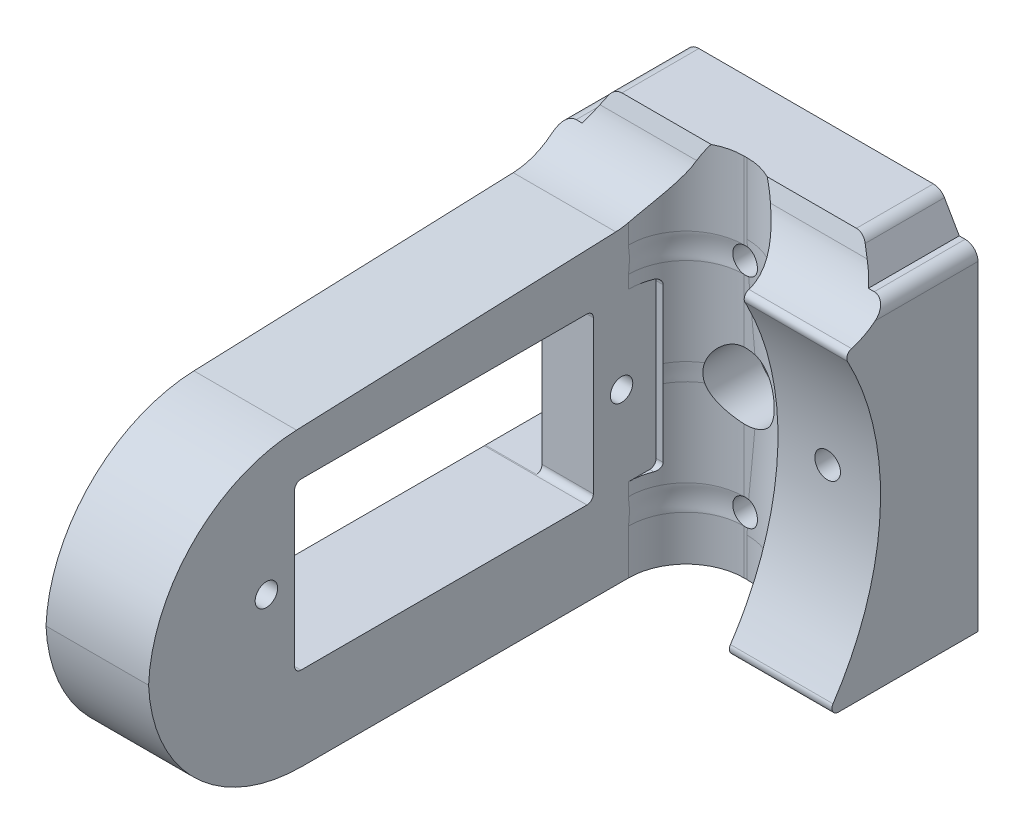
SolidWorks part; units mm, degrees
ref_plane "Front Plane" through (0, 0, 0) normal (0, 0, 1) x (1, 0, 0)
ref_plane "Top Plane" through (0, 0, 0) normal (0, 1, 0) x (1, 0, 0)
ref_plane "Right Plane" through (0, 0, 0) normal (1, 0, 0) x (0, 0, -1)
sketch "Sketch1" plane through (0, 0, 0) normal (0, 0, 1) x (1, 0, 0)
  line L0 (-508.3457, 285.8994) -> (-508.3457, 283.7994) construction
  line L1 (-509.3071, 286.3994) -> (-508.8457, 286.3994) construction
  line L2 (-532.5957, 283.7994) -> (-532.5957, 285.8994) construction
  line L3 (-532.0957, 286.3994) -> (-531.6344, 286.3994) construction
  line L4 (-531.2014, 286.6494) -> (-530.0467, 288.6494) construction
  line L5 (-510.8948, 288.6494) -> (-509.7401, 286.6494) construction
  line L6 (-529.6137, 288.8994) -> (-511.3278, 288.8994) construction
  line L7 (-508.3457, 285.8994) -> (-508.3457, 283.7994) construction
  line L8 (-509.3071, 286.3994) -> (-508.8457, 286.3994) construction
  line L9 (-532.5957, 283.7994) -> (-532.5957, 285.8994) construction
  line L10 (-532.0957, 286.3994) -> (-531.6344, 286.3994) construction
  line L11 (-531.2014, 286.6494) -> (-530.0467, 288.6494) construction
  line L12 (-510.8948, 288.6494) -> (-509.7401, 286.6494) construction
  line L13 (-529.6137, 288.8994) -> (-511.3278, 288.8994) construction
  line L14 (-532.5957, 283.7994) -> (-532.5957, 261.3994) construction
  line L15 (-506.3457, 261.3994) -> (-534.5957, 261.3994) construction
  line L16 (-532.5957, 261.3994) -> (-508.3457, 261.3994) construction
  line L17 (-508.3457, 261.3994) -> (-508.3457, 283.7994) construction
  line L18 (-531.6344, 286.8994) -> (-530.4797, 288.8994)
  line L19 (-529.6137, 289.3994) -> (-511.3278, 289.3994)
  line L20 (-510.4618, 288.8994) -> (-509.3071, 286.8994)
  line L21 (-509.3071, 286.8994) -> (-508.8457, 286.8994)
  line L22 (-507.8457, 285.8994) -> (-507.8457, 283.7994)
  line L23 (-507.8457, 260.8994) -> (-507.8457, 283.7994)
  line L24 (-533.0957, 260.8994) -> (-507.8457, 260.8994)
  line L25 (-533.0957, 283.7994) -> (-533.0957, 260.8994)
  line L26 (-533.0957, 283.7994) -> (-533.0957, 285.8994)
  line L27 (-532.0957, 286.8994) -> (-531.6344, 286.8994)
  arc A0 (-508.3457, 285.8994) -> (-508.8457, 286.3994) centre (-508.8457, 285.8994) ccw construction
  arc A1 (-509.7401, 286.6494) -> (-509.3071, 286.3994) centre (-509.3071, 286.8994) ccw construction
  arc A2 (-510.8948, 288.6494) -> (-511.3278, 288.8994) centre (-511.3278, 288.3994) ccw construction
  arc A3 (-532.0957, 286.3994) -> (-532.5957, 285.8994) centre (-532.0957, 285.8994) ccw construction
  arc A4 (-531.6344, 286.3994) -> (-531.2014, 286.6494) centre (-531.6344, 286.8994) ccw construction
  arc A5 (-529.6137, 288.8994) -> (-530.0467, 288.6494) centre (-529.6137, 288.3994) ccw construction
  arc A6 (-508.3457, 285.8994) -> (-508.8457, 286.3994) centre (-508.8457, 285.8994) ccw construction
  arc A7 (-509.7401, 286.6494) -> (-509.3071, 286.3994) centre (-509.3071, 286.8994) ccw construction
  arc A8 (-510.8948, 288.6494) -> (-511.3278, 288.8994) centre (-511.3278, 288.3994) ccw construction
  arc A9 (-532.0957, 286.3994) -> (-532.5957, 285.8994) centre (-532.0957, 285.8994) ccw construction
  arc A10 (-531.6344, 286.3994) -> (-531.2014, 286.6494) centre (-531.6344, 286.8994) ccw construction
  arc A11 (-529.6137, 288.8994) -> (-530.0467, 288.6494) centre (-529.6137, 288.3994) ccw construction
  arc A12 (-529.6137, 289.3994) -> (-530.4797, 288.8994) centre (-529.6137, 288.3994) ccw
  arc A13 (-510.4618, 288.8994) -> (-511.3278, 289.3994) centre (-511.3278, 288.3994) ccw
  arc A14 (-509.3071, 286.8994) -> (-509.3071, 286.8994) centre (-509.3071, 286.8994) ccw
  arc A15 (-507.8457, 285.8994) -> (-508.8457, 286.8994) centre (-508.8457, 285.8994) ccw
  arc A16 (-532.0957, 286.8994) -> (-533.0957, 285.8994) centre (-532.0957, 285.8994) ccw
  arc A17 (-531.6344, 286.8994) -> (-531.6344, 286.8994) centre (-531.6344, 286.8994) ccw
  dimension "D1" = 0.5
extrude "Boss-Extrude1" add sketch "Sketch1" along normal offset from surface (47.45 mm away) 7
sketch "Sketch2" plane through (0, 289.3994, 0) normal (0, 1, 0) x (1, 0, 0)
  line L1 (-515.8457, -49.7595) -> (-525.0957, -49.7595)
  line L2 (-515.8457, -49.7595) -> (-515.8457, -5.5)
  line L3 (-515.8457, -5.5) -> (-525.0957, -5.5)
  line L4 (-525.0957, -49.7595) -> (-525.0957, -5.5)
  line L5 (-511.3278, 0) -> (-529.6137, 0) construction
  line L7 (-533.0957, -47.45) -> (-533.0957, 0) construction
  line L9 (-507.8457, -47.45) -> (-507.8457, 0) construction
  dimension "D1" = 8
  dimension "D2" = 5.5
  dimension "D3" = 8
extrude "Cut-Extrude1" cut sketch "Sketch2" against normal through all contours L2 L1 L4 L3
ref_plane "Plane1" through (-520.4707, 0, 0) normal (-1, 0, 0) x (0, 0, 1)
sketch "Sketch4" plane through (-520.4707, 0, 0) normal (-1, 0, 0) x (0, 0, 1)
  line L0 (6, 289.3994) -> (6.4419, 288.1864)
  line L1 (47.45, 289.3994) -> (0, 289.3994) construction
  line L2 (11, 284.771) -> (47.45, 283.3994)
  line L4 (6, 289.3994) -> (47.45, 289.3994)
  line L6 (47.45, 289.3994) -> (47.45, 283.3994)
  line L7 (0, 288.8994) -> (0, 289.3994) construction
  line L8 (47.45, 286.8994) -> (47.45, 288.8994) construction
  arc A0 (11, 284.771) -> (6.4419, 288.1864) centre (11.1853, 289.7676) cw
  point P14 (7, 282.7437)
  dimension "D3" = 5
  dimension "D1" = 6
  dimension "D2" = 6
  dimension "D4" = 5
extrude "Cut-Extrude2" cut sketch "Sketch4" against normal through all both and the other way through all
sketch "Sketch5" plane through (-507.8457, 0, 0) normal (1, 0, 0) x (0, 0, -1)
  line L0 (-29.6, 273.8994) -> (-11.1, 273.8994) construction
  line L1 (0, 285.8994) -> (0, 260.8994) construction
  line L2 (-11.1, 273.8994) -> (-7.6, 273.8994) construction
  line L3 (-51.6, 273.8994) -> (-51.6, 251.8994)
  line L4 (0, 260.8994) -> (0, 285.8994) construction
  line L5 (-51.6, 251.8994) -> (-29.6, 251.8994)
  circle A0 centre (-29.6, 273.8994) radius 2.5498 construction
  circle A1 centre (-29.6, 273.8994) radius 2.5498 construction
  arc A2 (-29.6, 251.8994) -> (-51.6, 273.8994) centre (-29.6, 273.8994) ccw
  dimension "D1" = 18.5
  dimension "D2" = 11.1
  dimension "D3" = 3.5
  dimension "D4" = 7.6
extrude "Cut-Extrude3" cut sketch "Sketch5" against normal up to surface and the other way through all
sketch "Sketch6" plane through (-525.0957, 0, 0) normal (1, 0, 0) x (0, 0, -1)
  circle A0 centre (-38.25, 273.8994) radius 0.875
  circle A1 centre (-10.55, 273.8994) radius 0.875
  dimension "D1" = 1.75
  dimension "D2" = 1.75
extrude "Cut-Extrude4" cut sketch "Sketch6" against normal through all
sketch "Sketch7" plane through (0, 0, 0) normal (0, 0, -1) x (-1, 0, 0)
  circle A26 centre (520.4707, 273.8994) radius 3.05 construction
  circle A27 centre (520.4707, 273.8994) radius 3.05 construction
  circle A28 centre (520.4707, 273.8994) radius 8.5 construction
  circle A29 centre (520.4707, 282.3994) radius 1
  circle A30 centre (511.9707, 273.8994) radius 1
  circle A31 centre (520.4707, 265.3994) radius 1
  circle A32 centre (528.9707, 273.8994) radius 1
  dimension "D1" = 2
  dimension "D2" = 2
  dimension "D3" = 2
  dimension "D4" = 2
extrude "Cut-Extrude5" cut sketch "Sketch7" against normal blind 8
fillet "Fillet1" radius 12 2 edges at (-529.0957, 260.8994, 47.45) (-529.0957, 283.3994, 47.45)
sketch "Sketch8" plane through (-533.0957, 0, 0) normal (-1, 0, 0) x (0, 0, 1)
  line L5 (35.8, 268.1994) -> (35.8, 271.6723) construction
  line L6 (13, 279.5994) -> (13, 268.1994) construction
  line L7 (13.5, 267.6994) -> (27.3729, 267.6994) construction
  line L8 (27.3729, 280.0994) -> (13.5, 280.0994) construction
  line L9 (35.8, 268.1994) -> (35.8, 271.6723) construction
  line L10 (13, 279.5994) -> (13, 268.1994) construction
  line L11 (13.5, 267.6994) -> (27.3729, 267.6994) construction
  line L12 (27.3729, 280.0994) -> (13.5, 280.0994) construction
  line L13 (12.75, 280.3494) -> (36.05, 280.3494)
  line L14 (13, 280.0994) -> (35.8, 280.0994) construction
  line L15 (13, 280.0994) -> (13, 267.6994) construction
  line L16 (13, 267.6994) -> (35.8, 267.6994) construction
  line L17 (35.8, 280.0994) -> (35.8, 267.6994) construction
  line L18 (13, 280.0994) -> (35.8, 267.6994) construction
  line L19 (13, 267.6994) -> (35.8, 280.0994) construction
  line L20 (36.05, 280.3494) -> (36.05, 267.4494)
  line L21 (12.75, 267.4494) -> (36.05, 267.4494)
  line L22 (12.75, 280.3494) -> (12.75, 267.4494)
  point P0 (24.4, 273.8994)
  dimension "D1" = 0.25
extrude "Cut-Extrude8" cut sketch "Sketch8" against normal up to surface (8 mm away)
fillet "Fillet2" radius 0.5 4 edges at (-529.0957, 280.3494, 36.05) (-529.0957, 267.4494, 36.05) (-529.0957, 267.4494, 12.75) (-529.0957, 280.3494, 12.75)
fillet "Fillet4" radius 4.5 2 edges at (-515.8457, 275.1494, 5.5) (-525.0957, 275.1494, 5.5)
sketch "Sketch9" plane through (-525.0957, 0, 0) normal (1, 0, 0) x (0, 0, -1)
  line L0 (-13.0101, 279.8994) -> (-8.55, 279.8994) construction
  line L1 (-7.85, 267.3994) -> (-13.25, 267.3994)
  line L2 (-7.85, 267.3994) -> (-7.85, 280.3994)
  line L3 (-7.85, 280.3994) -> (-13.25, 280.3994)
  line L4 (-13.25, 267.3994) -> (-13.25, 280.3994)
  line L5 (-7.85, 267.3994) -> (-13.25, 280.3994) construction
  line L6 (-7.85, 280.3994) -> (-13.25, 267.3994) construction
  line L7 (-8.35, 279.6994) -> (-8.35, 274.3494) construction
  point P0 (-10.55, 273.8994)
  dimension "D1" = 0.5
  dimension "D2" = 0.5
extrude "Cut-Extrude9" cut sketch "Sketch9" along normal blind 5.25
fillet "Fillet6" radius 0.5 2 edges at (-524.8223, 280.3994, 7.85) (-524.8223, 267.3994, 7.85)
fillet "Fillet7" radius 0.5 2 edges at (-511.8457, 260.8994, 11.8518) (-511.8457, 284.8149, 10.4989)
sketch "Sketch10" plane through (0, 0, 0) normal (0, 0, -1) x (-1, 0, 0)
  line L2 (520.4707, 282.3994) -> (520.4707, 265.3994) construction
  circle A1 centre (520.4707, 273.8994) radius 6
  dimension "D1" = 12
extrude "Cut-Extrude10" cut sketch "Sketch10" against normal blind 2
sketch "Sketch11" plane through (0, 0, 2) normal (0, 0, -1) x (-1, 0, 0)
  circle A0 centre (520.4707, 273.8994) radius 2.6
  circle A1 centre (520.4707, 273.8994) radius 6 construction
  circle A2 centre (520.4707, 273.8994) radius 6 construction
  point P3 (529.0551, 273.9041)
  point P4 (523.8728, 276.0802)
  point P7 (0, 0)
  dimension "D1" = 5.2
extrude "Cut-Extrude11" cut sketch "Sketch11" against normal through all
sketch "Sketch12" plane through (-533.0957, 0, 0) normal (-1, 0, 0) x (0, 0, 1)
  line L4 (40.45, 279.6994) -> (40.45, 274.3494) construction
  line L5 (7.85, 267.4564) -> (40.95, 267.4564)
  line L6 (7.85, 267.4564) -> (7.85, 280.3425)
  line L7 (7.85, 280.3425) -> (40.95, 280.3425)
  line L8 (40.95, 267.4564) -> (40.95, 280.3425)
  line L9 (7.85, 267.4564) -> (40.95, 280.3425) construction
  line L10 (7.85, 280.3425) -> (40.95, 267.4564) construction
  point P3 (24.4, 273.8994)
  dimension "D1" = 0.5
extrude "Cut-Extrude12" cut sketch "Sketch12" against normal blind 4
fillet "Fillet8" radius 0.5 4 edges at (-531.0957, 267.4564, 7.85) (-531.0957, 280.3425, 7.85) (-531.0957, 267.4564, 40.95) (-531.0957, 280.3425, 40.95)
